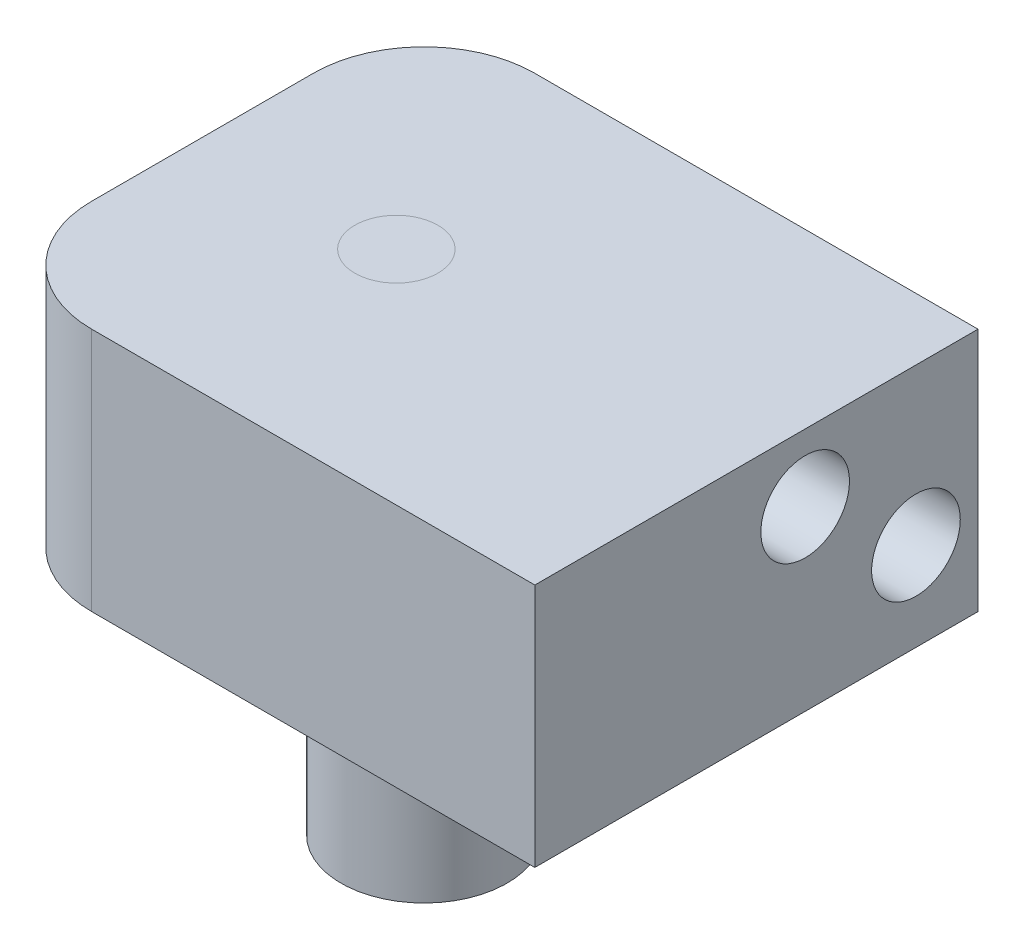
SolidWorks part; units mm, degrees
ref_plane "Plane1" through (0, 0, 0) normal (0, 0, 1) x (1, 0, 0)
ref_plane "Plane2" through (0, 0, 0) normal (0, 1, 0) x (1, 0, 0)
ref_plane "Plane3" through (0, 0, 0) normal (1, 0, 0) x (0, 0, -1)
sketch "Sketch1" plane through (0, 0, 0) normal (0, 0, 1) x (1, 0, 0)
  line L1 (0, 0) -> (31.75, 0)
  line L2 (0, 0) -> (0, 14.0208)
  line L3 (0, 14.0208) -> (31.75, 14.0208)
  line L4 (31.75, 0) -> (31.75, 14.0208)
  dimension "D1" = 31.75
  dimension "D2" = 14.0208
extrude "Base-Extrude" add sketch "Sketch1" along normal blind 25.4
sketch "Sketch2" plane through (0, 0, 0) normal (0, -1, 0) x (1, 0, 0)
  line L0 (0, 25.4) -> (31.75, 25.4) construction
  line L1 (0, 25.4) -> (0, 0) construction
  circle A0 centre (12.7, 12.7) radius 8.255
  dimension "D1" = 16.51
  dimension "D2" = 12.7
  dimension "D3" = 12.7
extrude "Boss-Extrude1" add sketch "Sketch2" along normal blind 1.27
sketch "Sketch3" plane through (0, -1.27, 0) normal (0, -1, 0) x (1, 0, 0)
  circle A0 centre (12.7, 12.7) radius 4.7625
  circle A1 centre (12.7, 12.7) radius 8.255 construction
  dimension "D1" = 9.525
extrude "Boss-Extrude2" add sketch "Sketch3" along normal blind 13.0048
fillet "Fillet3" radius 6.35 2 edges at (0, 7.0104, 25.4) (0, 7.0104, 0)
sketch "Sketch4" plane through (31.75, 0, 0) normal (1, 0, 0) x (0, 0, -1)
  line L0 (-25.4, 0) -> (0, 0) construction
  circle A2 centre (-9.906, 10.16) radius 2.54
  circle A3 centre (-3.556, 5.08) radius 2.54
  dimension "D1" = 5.08
extrude "Extrude1" cut sketch "Sketch4" against normal blind 10
sketch "Sketch5" plane through (0, 14.0208, 0) normal (0, 1, 0) x (1, 0, 0)
  line L0 (0, -12.7) -> (11.1125, -12.7) construction
  line L1 (0, -19.05) -> (0, -6.35) construction
  circle A0 centre (11.1125, -12.7) radius 2.3813
  dimension "D1" = 11.1125
  dimension "D2" = 4.7625
